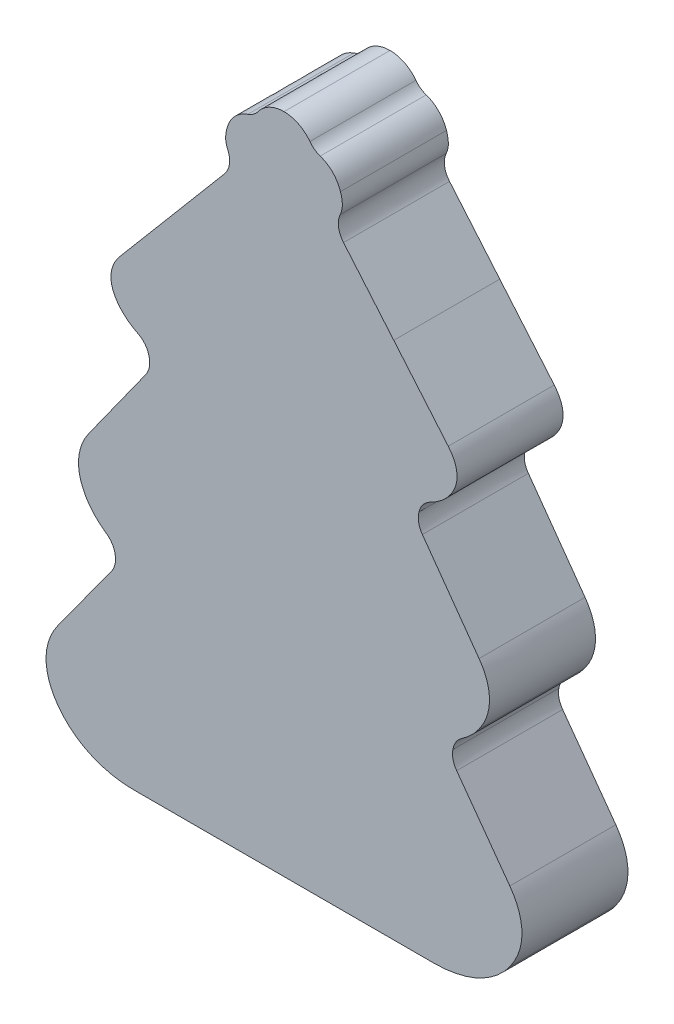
SolidWorks part; units mm, degrees
ref_plane "Front Plane" through (0, 0, 0) normal (0, 0, 1) x (1, 0, 0)
ref_plane "Top Plane" through (0, 0, 0) normal (0, 1, 0) x (1, 0, 0)
ref_plane "Right Plane" through (0, 0, 0) normal (1, 0, 0) x (0, 0, -1)
sketch "Sketch1" plane through (0, 0, 0) normal (0, 0, 1) x (1, 0, 0)
  line L0 (364.1056, 429.7434) -> (367.899, 425.2518)
  spline S0 degree 2 poles (367.899, 425.2518) (367.899, 425.2518) (372.0094, 420.3849) knots 0.02439 0.02439 0.02439 0.04878 0.04878 0.04878
  spline S1 degree 3 poles (372.0094, 420.3849) (372.8946, 419.3368) (372.8946, 418.137) (372.0094, 417.0889) knots 0.04878 0.04878 0.04878 0.04878 0.073171 0.073171 0.073171 0.073171
  spline S2 degree 3 poles (372.0094, 417.0889) (371.6533, 416.6672) (371.1944, 416.318) (370.658, 416.0514) knots 0.073171 0.073171 0.073171 0.073171 0.097561 0.097561 0.097561 0.097561
  spline S3 degree 3 poles (370.658, 416.0514) (370.2143, 415.8309) (369.9199, 415.4647) (369.8004, 414.9839) knots 0.097561 0.097561 0.097561 0.097561 0.121951 0.121951 0.121951 0.121951
  spline S4 degree 3 poles (369.8004, 414.9839) (369.6807, 414.5031) (369.7689, 414.0416) (370.0574, 413.6389) knots 0.121951 0.121951 0.121951 0.121951 0.146341 0.146341 0.146341 0.146341
  spline S5 degree 2 poles (370.0574, 413.6389) (370.0574, 413.6389) (374.3337, 407.6695) knots 0.146341 0.146341 0.146341 0.170732 0.170732 0.170732
  spline S6 degree 3 poles (374.3337, 407.6695) (375.3849, 406.2023) (375.3849, 404.5226) (374.3337, 403.0552) knots 0.170732 0.170732 0.170732 0.170732 0.195122 0.195122 0.195122 0.195122
  spline S7 degree 3 poles (374.3337, 403.0552) (373.9828, 402.5653) (373.5478, 402.1454) (373.0461, 401.8034) knots 0.195122 0.195122 0.195122 0.195122 0.219512 0.219512 0.219512 0.219512
  spline S8 degree 3 poles (373.0461, 401.8034) (372.6676, 401.5455) (372.4358, 401.1856) (372.3571, 400.7344) knots 0.219512 0.219512 0.219512 0.219512 0.243902 0.243902 0.243902 0.243902
  spline S9 degree 3 poles (372.3571, 400.7344) (372.2786, 400.2832) (372.3753, 399.8662) (372.6443, 399.4955) knots 0.243902 0.243902 0.243902 0.243902 0.268293 0.268293 0.268293 0.268293
  spline S10 degree 2 poles (372.6443, 399.4955) (372.6443, 399.4955) (376.6581, 393.9654) knots 0.268293 0.268293 0.268293 0.292683 0.292683 0.292683
  spline S11 degree 3 poles (376.6581, 393.9654) (377.8753, 392.2886) (377.8753, 390.369) (376.6581, 388.6919) knots 0.292683 0.292683 0.292683 0.292683 0.317073 0.317073 0.317073 0.317073
  spline S12 degree 3 poles (376.6581, 388.6919) (375.4409, 387.0148) (373.3512, 386.0552) (370.9167, 386.0552) knots 0.317073 0.317073 0.317073 0.317073 0.341463 0.341463 0.341463 0.341463
  spline S13 degree 2 poles (370.9167, 386.0552) (370.9167, 386.0552) (359.613, 386.0552) knots 0.341463 0.341463 0.341463 0.365854 0.365854 0.365854
  spline S14 degree 2 poles (359.613, 386.0552) (359.613, 386.0552) (348.3093, 386.0552) knots 0.365854 0.365854 0.365854 0.390244 0.390244 0.390244
  spline S15 degree 3 poles (348.3093, 386.0552) (345.8748, 386.0552) (343.7851, 387.0148) (342.5679, 388.6919) knots 0.390244 0.390244 0.390244 0.390244 0.414634 0.414634 0.414634 0.414634
  spline S16 degree 3 poles (342.5679, 388.6919) (341.3507, 390.369) (341.3507, 392.2886) (342.5679, 393.9654) knots 0.414634 0.414634 0.414634 0.414634 0.439024 0.439024 0.439024 0.439024
  spline S17 degree 2 poles (342.5679, 393.9654) (342.5679, 393.9654) (346.5817, 399.4955) knots 0.439024 0.439024 0.439024 0.463415 0.463415 0.463415
  spline S18 degree 3 poles (346.5817, 399.4955) (346.8507, 399.8662) (346.9474, 400.2832) (346.8689, 400.7344) knots 0.463415 0.463415 0.463415 0.463415 0.487805 0.487805 0.487805 0.487805
  spline S19 degree 3 poles (346.8689, 400.7344) (346.7902, 401.1856) (346.5584, 401.5455) (346.1799, 401.8034) knots 0.487805 0.487805 0.487805 0.487805 0.512195 0.512195 0.512195 0.512195
  spline S20 degree 3 poles (346.1799, 401.8034) (345.6782, 402.1454) (345.2432, 402.5655) (344.8923, 403.0552) knots 0.512195 0.512195 0.512195 0.512195 0.536585 0.536585 0.536585 0.536585
  spline S21 degree 3 poles (344.8923, 403.0552) (343.8413, 404.5226) (343.8411, 406.2023) (344.8923, 407.6695) knots 0.536585 0.536585 0.536585 0.536585 0.560976 0.560976 0.560976 0.560976
  spline S22 degree 2 poles (344.8923, 407.6695) (344.8923, 407.6695) (349.1686, 413.6389) knots 0.560976 0.560976 0.560976 0.585366 0.585366 0.585366
  spline S23 degree 3 poles (349.1686, 413.6389) (349.4571, 414.0416) (349.5453, 414.5031) (349.4256, 414.9839) knots 0.585366 0.585366 0.585366 0.585366 0.609756 0.609756 0.609756 0.609756
  spline S24 degree 3 poles (349.4256, 414.9839) (349.3059, 415.4647) (349.0117, 415.8309) (348.568, 416.0514) knots 0.609756 0.609756 0.609756 0.609756 0.634146 0.634146 0.634146 0.634146
  spline S25 degree 3 poles (348.568, 416.0514) (348.0316, 416.318) (347.5727, 416.6674) (347.2166, 417.0889) knots 0.634146 0.634146 0.634146 0.634146 0.658537 0.658537 0.658537 0.658537
  spline S26 degree 3 poles (347.2166, 417.0889) (346.3316, 418.137) (346.3314, 419.3368) (347.2166, 420.3849) knots 0.658537 0.658537 0.658537 0.658537 0.682927 0.682927 0.682927 0.682927
  spline S27 degree 2 poles (347.2166, 420.3849) (347.2166, 420.3849) (351.327, 425.2518) knots 0.682927 0.682927 0.682927 0.707317 0.707317 0.707317
  spline S28 degree 2 poles (351.327, 425.2518) (351.327, 425.2518) (355.1204, 429.7433) knots 0.707317 0.707317 0.707317 0.731707 0.731707 0.731707
  spline S29 degree 3 poles (355.1204, 429.7433) (355.531, 430.2295) (355.624, 430.8645) (355.37, 431.4482) knots 0.731707 0.731707 0.731707 0.731707 0.756098 0.756098 0.756098 0.756098
  spline S30 degree 3 poles (355.37, 431.4482) (355.1929, 431.8551) (355.1258, 432.2644) (355.3511, 432.9583) knots 0.756098 0.756098 0.756098 0.756098 0.780488 0.780488 0.780488 0.780488
  spline S31 degree 3 poles (355.3511, 432.9583) (355.5938, 433.706) (356.1634, 434.2729) (356.8801, 434.518) knots 0.780488 0.780488 0.780488 0.780488 0.804878 0.804878 0.804878 0.804878
  spline S32 degree 3 poles (356.8801, 434.518) (357.2039, 434.6287) (357.4525, 434.8092) (357.6577, 435.0829) knots 0.804878 0.804878 0.804878 0.804878 0.829268 0.829268 0.829268 0.829268
  spline S33 degree 3 poles (357.6577, 435.0829) (358.1122, 435.6887) (358.8273, 436.0552) (359.6132, 436.0552) knots 0.829268 0.829268 0.829268 0.829268 0.853659 0.853659 0.853659 0.853659
  spline S34 degree 3 poles (359.6132, 436.0552) (360.3991, 436.0552) (361.1141, 435.6885) (361.5685, 435.0829) knots 0.853659 0.853659 0.853659 0.853659 0.878049 0.878049 0.878049 0.878049
  spline S35 degree 3 poles (361.5685, 435.0829) (361.7737, 434.8092) (362.0223, 434.6285) (362.3459, 434.5178) knots 0.878049 0.878049 0.878049 0.878049 0.902439 0.902439 0.902439 0.902439
  spline S36 degree 3 poles (362.3459, 434.5178) (363.0624, 434.2726) (363.6322, 433.706) (363.8749, 432.9584) knots 0.902439 0.902439 0.902439 0.902439 0.926829 0.926829 0.926829 0.926829
  spline S37 degree 3 poles (363.8749, 432.9584) (364.1002, 432.2646) (364.0331, 431.8553) (363.856, 431.4482) knots 0.926829 0.926829 0.926829 0.926829 0.95122 0.95122 0.95122 0.95122
  spline S38 degree 3 poles (363.856, 431.4482) (363.6021, 430.8647) (363.695, 430.2296) (364.1056, 429.7434) knots 0.95122 0.95122 0.95122 0.95122 1 1 1 1
extrude "Boss-Extrude1" add sketch "Sketch1" along normal blind 8
